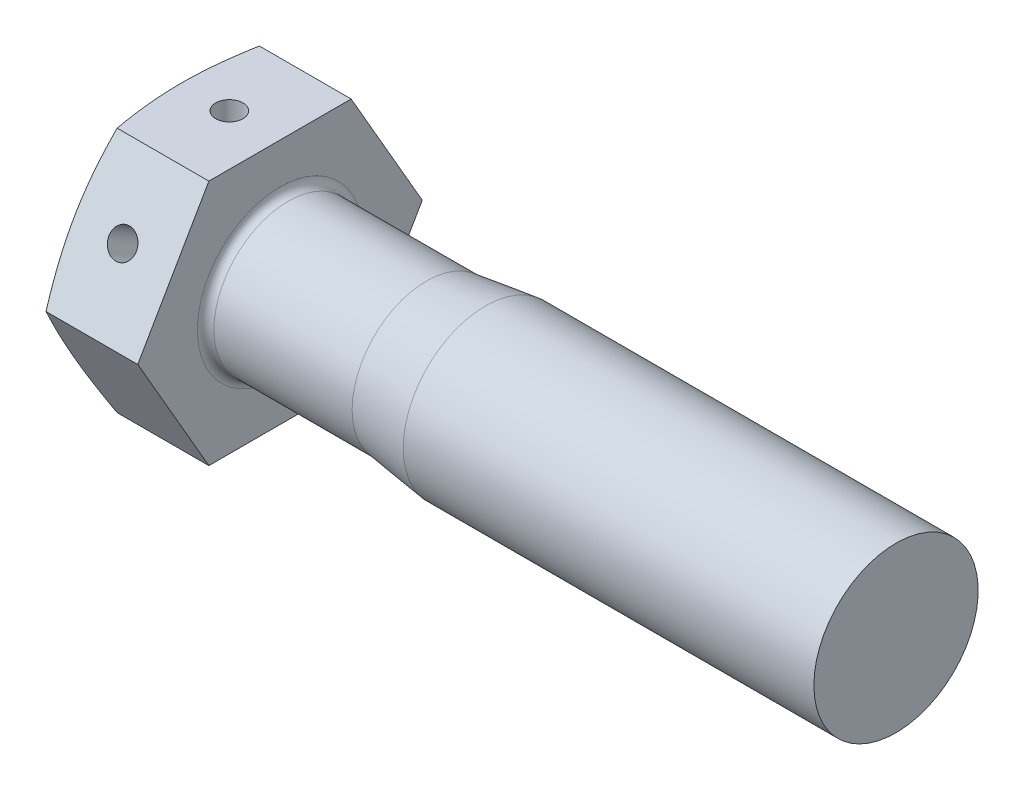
SolidWorks part; units mm, degrees
ref_plane "Front" through (0, 0, 0) normal (0, 0, 1) x (1, 0, 0)
ref_plane "Top" through (0, 0, 0) normal (0, 1, 0) x (1, 0, 0)
ref_plane "Right" through (0, 0, 0) normal (1, 0, 0) x (0, 0, -1)
sketch "Sketch1" plane through (0, 0, 0) normal (1, 0, 0) x (0, 0, -1)
  line L1 (10.3923, 0) -> (5.1962, 9)
  line L2 (5.1962, 9) -> (-5.1962, 9)
  line L3 (-5.1962, 9) -> (-10.3923, 0)
  line L4 (-10.3923, 0) -> (-5.1962, -9)
  line L5 (-5.1962, -9) -> (5.1962, -9)
  line L6 (5.1962, -9) -> (10.3923, 0)
  circle A0 centre (0, 0) radius 9 construction
  dimension "s" = 18
extrude "BaseHead" add sketch "Sketch1" along normal blind 7.5
ref_plane "Plane1" through (22.5, 0, 0) normal (1, 0, 0) x (0, 0, -1)
sketch "Sketch2" plane through (7.5, 0, 0) normal (1, 0, 0) x (0, 0, -1)
  circle A0 centre (0, 0) radius 6
  dimension "d" = 12
extrude "BaseBody" add sketch "Sketch2" along normal blind 45
sketch "Sketch3" plane through (3.1612, 0, 2.6123) normal (0, 1, 0) x (0, 0, -1)
  line L0 (2.6123, 5.2326) -> (2.6123, 1.6388) construction
  line L2 (13.0046, 3.1612) -> (13.0046, 2.3633)
  line L3 (13.0046, 2.3633) -> (10.8123, 3.1612)
  line L5 (10.8123, 3.1612) -> (13.0046, 3.1612)
  dimension "D1" = 20
  dimension "dw" = 16.4
revolve "HeadChamfer" cut sketch "Sketch3" angle 360 about L0
sketch "Sketch4" plane through (0, 0, 0) normal (-1, 0, 0) x (0, 0, 1)
  circle A0 centre (0, 0) radius 6.85
  dimension "da" = 13.7
extrude "Cut-Extrude1" cut sketch "Sketch4" against normal blind 1.5
sketch "Sketch5" plane through (-2.9296, 0, 7.9296) normal (0, 1, 0) x (0, 0, -1)
  line L0 (7.9296, -0.2325) -> (7.9296, -16.4861) construction
  line L1 (7.9296, -55.4296) -> (7.9296, -10.4296) construction
  line L2 (13.9296, -25.4296) -> (13.3611, -21.1296)
  line L3 (1.9296, -55.4296) -> (13.9296, -55.4296) construction
  line L4 (13.3611, -21.1296) -> (13.3611, -10.4296)
  line L5 (13.9296, -55.4296) -> (13.9296, -10.4296) construction
  line L6 (13.3611, -10.4296) -> (18.7926, -10.4296)
  line L7 (18.7926, -10.4296) -> (18.7926, -25.4296)
  line L8 (18.7926, -25.4296) -> (13.9296, -25.4296)
  line L9 (18.3219, -10.4296) -> (13.1258, -10.4296) construction
  dimension "ds" = 10.863
  dimension "x" = 4.3
  dimension "D3" = 30
  dimension "D4" = 21.726
revolve "Cut-Revolve1" cut sketch "Sketch5" angle 360 about L0
fillet "HeadFillet" radius 0.6 1 edges at (7.5, 0, 5.4315)
sketch "Sketch6" plane through (0, 0, 0) normal (0, 1, 0) x (1, 0, 0)
  line L0 (-2.6972, 0) -> (13.5564, 0) construction
  line L1 (7.5, 10.3923) -> (7.5, 5.1962) construction
  circle A0 centre (3.8, 0) radius 1
  dimension "d1" = 2
  dimension "h" = 3.7
extrude "Hole" cut sketch "Sketch6" against normal through all and the other way through all
pattern_circular "CirPattern1" count 2 over 60 about axis through (-2.6972, 0, 0) along (1, 0, 0) of "Hole"
equation "\"D1@Cut-Extrude1\" = 0.2 * \"k@BaseHead\""
equation "\"b@ThreadCosmetic1\" = \"l@BaseBody\" - \"lg@Plane1\""
equation "\"D4@Sketch5\" = 2 * \"ds@Sketch5\""
equation "\"D3@Sketch5\" =\"l@BaseBody\" - \"lg@Plane1\""
